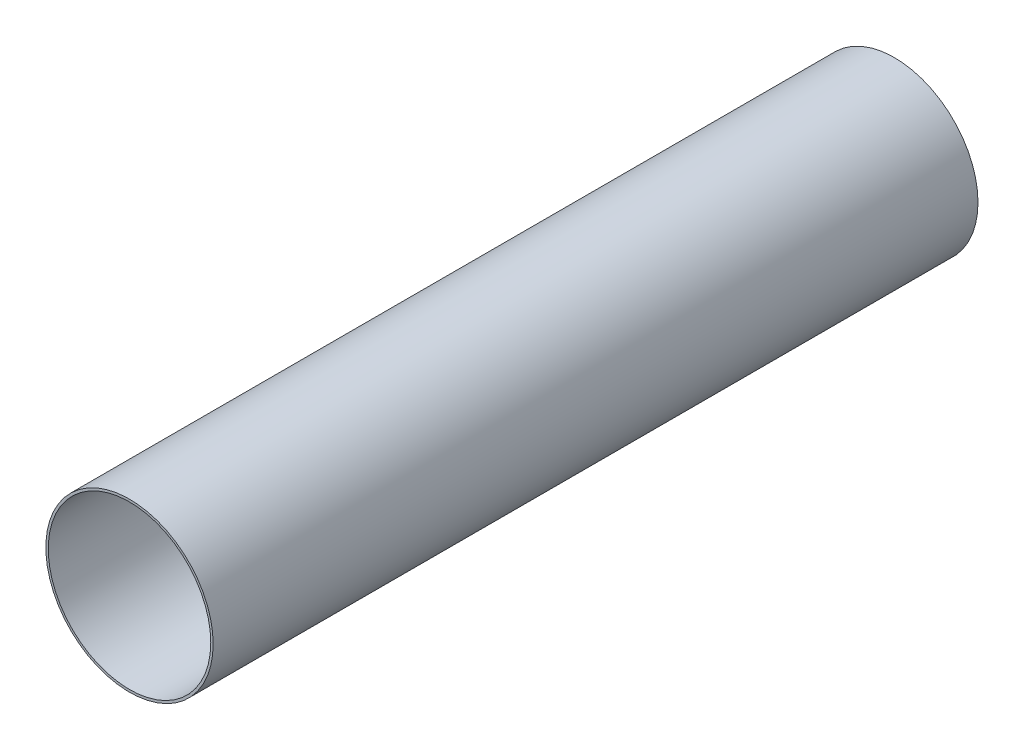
SolidWorks part; units mm, degrees
ref_plane "Front Plane" through (0, 0, 0) normal (0, 0, 1) x (1, 0, 0)
ref_plane "Top Plane" through (0, 0, 0) normal (0, 1, 0) x (1, 0, 0)
ref_plane "Right Plane" through (0, 0, 0) normal (1, 0, 0) x (0, 0, -1)
sketch "Sketch1" plane through (0, 0, 0) normal (0, 0, 1) x (1, 0, 0)
  circle A0 centre (0, 0) radius 27.7813
  circle A1 centre (0, 0) radius 26.9875
  dimension "D1" = 53.975
  dimension "D2" = 55.5625
extrude "Extrude1" add sketch "Sketch1" along normal blind 254
